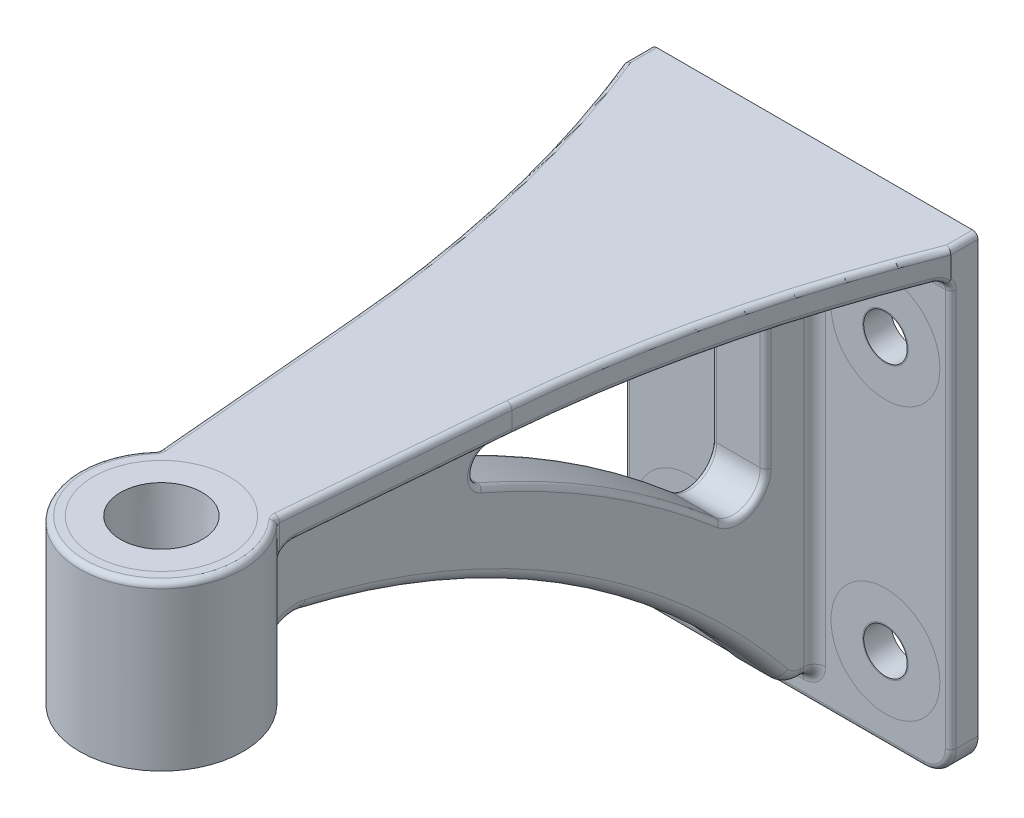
SolidWorks part; units mm, degrees
ref_plane "Front Plane" through (0, 0, 0) normal (0, 0, 1) x (1, 0, 0)
ref_plane "Top Plane" through (0, 0, 0) normal (0, 1, 0) x (1, 0, 0)
ref_plane "Right Plane" through (0, 0, 0) normal (1, 0, 0) x (0, 0, -1)
sketch "Sketch2" plane through (0, 0, 0) normal (0, 0, 1) x (1, 0, 0)
  line L1 (0, 0) -> (38.1, 0)
  line L2 (0, 0) -> (0, -107.95)
  line L3 (0, -107.95) -> (38.1, -107.95)
  line L4 (38.1, 0) -> (38.1, -107.95)
  dimension "D1" = 107.95
  dimension "D2" = 38.1
sketch "Sketch3" plane through (0, 0, 0) normal (1, 0, 0) x (0, 0, -1)
  line L0 (0, 0) -> (0, -101.6)
  line L1 (0, 0) -> (0, -107.95) construction
  line L2 (0, 0) -> (0, -107.95) construction
  line L3 (0, -101.6) -> (-12.7, -101.6)
  line L4 (0, 0) -> (-152.4, 0)
  line L5 (-152.4, 0) -> (-152.4, -25.4)
  arc A0 (-152.4, -25.4) -> (-12.7, -101.6) centre (-172.0833, -227.6444) cw
  dimension "D4" = 203.2
  dimension "D1" = 25.4
  dimension "D2" = 12.7
  dimension "D3" = 152.4
  dimension "D5" = 101.6
extrude "Boss-Extrude2" add sketch "Sketch3" along normal blind 6.35
extrude "Boss-Extrude3" add sketch "Sketch2" along normal blind 6.35
sketch "Sketch4" plane through (0, 0, 0) normal (0, 1, 0) x (1, 0, 0)
  line L0 (0, 0) -> (38.1, 0)
  line L1 (38.1, 0) -> (38.1, -6.35)
  line L2 (0, 0) -> (0, -152.4)
  line L3 (0, -152.4) -> (12.7, -152.4)
  line L4 (12.7, -152.4) -> (18.2555, -88.9)
  line L5 (18.2555, -88.9) -> (6.35, -88.9) construction
  line L6 (6.35, -6.35) -> (6.35, -152.4) construction
  arc A0 (18.2555, -88.9) -> (38.1, -6.35) centre (303.7945, -113.8814) cw
  dimension "D1" = 12.7
  dimension "D2" = 63.5
  dimension "D3" = 5
extrude "Boss-Extrude4" add sketch "Sketch4" against normal blind 6.35
sketch "Sketch5" plane through (0, 0, 6.35) normal (0, 0, 1) x (1, 0, 0)
  line L0 (22.86, -25.4) -> (22.86, -88.9) construction
  line L1 (0, -107.95) -> (38.1, -107.95) construction
  line L2 (6.35, -6.35) -> (38.1, -6.35) construction
  line L3 (38.1, -107.95) -> (38.1, -6.35) construction
  circle A0 centre (22.86, -25.4) radius 5.08
  circle A1 centre (22.86, -88.9) radius 5.08
  dimension "D4" = 10.16
  dimension "D1" = 19.05
  dimension "D2" = 19.05
  dimension "D3" = 15.24
extrude "Cut-Extrude1" cut sketch "Sketch5" against normal up to next
mirror "Mirror1" about plane through (0, -227.6444, 172.0833) normal (-1, 0, 0)
sketch "Sketch6" plane through (0, 0, 0) normal (0, 1, 0) x (1, 0, 0)
  line L0 (12.7, -152.4) -> (-12.7, -152.4) construction
  circle A0 centre (0, -152.4) radius 19.05
  dimension "D1" = 38.1
extrude "Boss-Extrude5" add sketch "Sketch6" against normal blind 38.1
sketch "Sketch7" plane through (0, 0, 0) normal (0, 1, 0) x (1, 0, 0)
  circle A0 centre (0, -152.4) radius 9.525
  dimension "D1" = 19.05
extrude "Cut-Extrude2" cut sketch "Sketch7" against normal up to next draft 3
fillet "Fillet1" radius 6.35 4 edges at (1.9825, -28.1501, 133.4534) (0, -101.6, 12.7) (38.1, -107.95, 3.175) (-38.1, -107.95, 3.175)
fillet "Fillet2" radius 2.54 19 edges at (6.35, -30.5702, 131.6146) (6.35, -101.6, 8.0026) (6.35, -100.9858, 12.3797) (22.225, -6.35, 6.35) (6.35, -6.35, 70.3947) (6.35, -21.0203, 134.4395) (6.35, -55.1477, 64.6817) (6.35, -53.975, 6.35) (-6.35, -53.975, 6.35) (-6.35, -101.6, 8.0026) (-6.35, -31.4852, 132.7233) (-6.35, -55.1477, 64.6817) (10.3875, -6.35, 136.4312) (-10.3875, -6.35, 136.4312) (-6.35, -21.0203, 134.4395) (-6.35, -6.35, 70.3947) (-22.225, -6.35, 6.35) (-6.35, -100.9858, 12.3797) (0, -101.6, 6.35)
fillet "Fillet3" radius 1.27 22 edges at (-25.1043, 0, 46.8862) (-16.0502, 0, 114.1074) (0, 0, 171.45) (16.0502, 0, 114.1074) (-38.1, 0, 3.175) (-13.8448, -4.445, 139.3148) (13.8448, -4.445, 139.3148) (38.1, 0, 3.175) (25.1043, 0, 46.8862) (13.8865, -7.5867, 138.8387) (16.1919, -6.35, 112.4873) (37.7541, -6.9862, 7.2086) (-13.9179, -7.2099, 138.479) (38.1, -55.245, 6.35) (36.2401, -106.0901, 6.35) (0, -107.95, 6.35) (-36.2401, -106.0901, 6.35) (-38.1, -55.245, 6.35) (-37.902, -7.3895, 6.8406) (-24.7879, -6.35, 48.2165) (24.7879, -6.35, 48.2165) (-16.1919, -6.35, 112.4873)
sketch "Sketch8" plane through (0, 0, 6.35) normal (0, 0, 1) x (1, 0, 0)
  circle A0 centre (22.86, -25.4) radius 12.7
  circle A1 centre (22.86, -25.4) radius 5.334
  circle A2 centre (22.86, -88.9) radius 12.7
  circle A3 centre (22.86, -88.9) radius 5.334
  circle A4 centre (-22.86, -88.9) radius 12.7
  circle A5 centre (-22.86, -88.9) radius 5.334
  circle A6 centre (-22.86, -25.4) radius 12.7
  circle A7 centre (-22.86, -25.4) radius 5.334
  dimension "D1" = 10.668
  dimension "D2" = 25.4
sketch "Sketch9" plane through (6.35, 0, 0) normal (1, 0, 0) x (0, 0, -1)
  line L8 (-17.78, -69.4589) -> (-17.78, -17.78)
  line L9 (-17.78, -17.78) -> (-102.8801, -17.78)
  line L10 (-17.78, -69.4589) -> (-17.78, -17.78)
  line L11 (-17.78, -17.78) -> (-102.8801, -17.78)
  arc A2 (-17.78, -69.4589) -> (-102.8801, -17.78) centre (-172.0833, -227.6444) ccw
  arc A3 (-17.78, -69.4589) -> (-102.8801, -17.78) centre (-172.0833, -227.6444) ccw
  dimension "D1" = 17.78
extrude "Cut-Extrude3" cut sketch "Sketch9" against normal through all
fillet "Fillet6" radius 6.35 1 edges at (0, -69.4589, 17.78)
fillet "Fillet4" radius 3.81 2 edges at (0, -17.78, 102.8801) (0, -17.78, 17.78)
fillet "Fillet5" radius 1.27 12 edges at (-6.35, -18.8959, 18.8959) (-6.35, -38.3201, 17.78) (-6.35, -40.4092, 54.7158) (-6.35, -20.8122, 85.9681) (6.35, -18.8959, 18.8959) (6.35, -38.3201, 17.78) (6.35, -40.4092, 54.7158) (6.35, -20.8122, 85.9681) (-6.35, -17.78, 51.9142) (6.35, -17.78, 51.9142) (-6.35, -60.8194, 21.4768) (6.35, -60.8194, 21.4768)
sketch "Sketch13" plane through (0, 0, 0) normal (0, 1, 0) x (1, 0, 0)
  circle A0 centre (0, -152.4) radius 15.875
  dimension "D1" = 31.75
